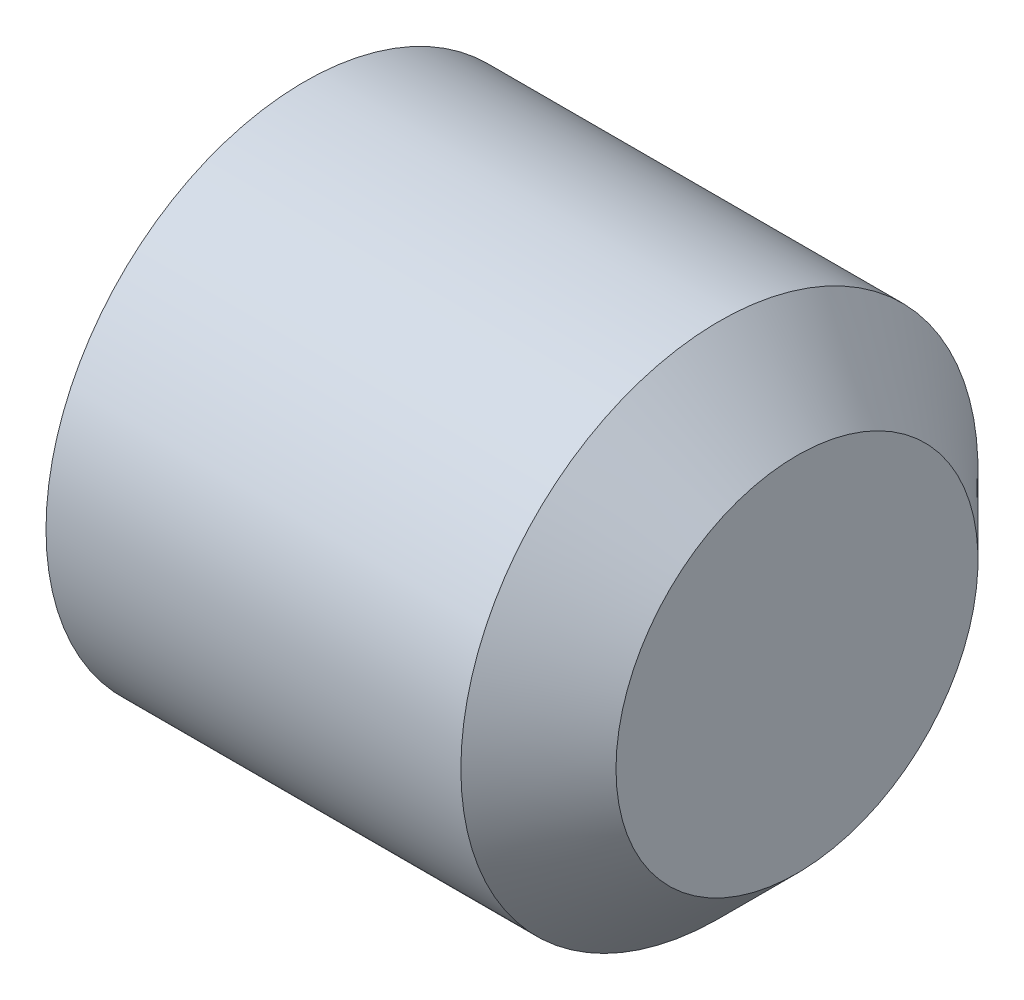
SolidWorks part; units mm, degrees
ref_plane "Plane1" through (0, 0, 0) normal (0, 0, 1) x (1, 0, 0)
ref_plane "Plane2" through (0, 0, 0) normal (0, 1, 0) x (1, 0, 0)
ref_plane "Plane3" through (0, 0, 0) normal (1, 0, 0) x (0, 0, -1)
sketch "BodySke" plane through (0, 0, 0) normal (0, 0, 1) x (1, 0, 0)
  line L0 (0, 0) -> (0, 4.172)
  line L1 (0, 4.172) -> (0.478, 5)
  line L2 (0.478, 5) -> (8.5, 5)
  line L3 (8.5, 5) -> (10, 3.5)
  line L4 (10, 0) -> (0, 0)
  line L5 (-12.7, 0) -> (88.9, 0) construction
  line L6 (10, 3.5) -> (10, 0)
  line L7 (10, 3.5) -> (10, 13.025) construction
  line L8 (0, -4.172) -> (0.478, -5) construction
  line L9 (1.5, 15.875) -> (1.5, -3.175) construction
  line L10 (8.5, -5) -> (10, -3.5) construction
  dimension "Length" = 10
  dimension "Diameter" = 10
  dimension "Drive_ch_ang" = 60
  dimension "Minor_dia" = 8.344
  dimension "Cup_nose_ang" = 45
  dimension "Cup_dia" = 7
  dimension "Advance" = 1.5
revolve "BaseBody" add sketch "BodySke" angle 360 about L5
sketch "Sketch2" plane through (0, 0, 0) normal (-1, 0, 0) x (0, 0, 1)
  line L0 (1.4434, 2.5) -> (-1.4434, 2.5)
  line L1 (-1.4434, 2.5) -> (-2.8868, 0)
  line L2 (1.4434, 2.5) -> (2.8868, 0)
  line L3 (1.4434, -2.5) -> (2.8868, 0)
  line L4 (1.4434, -2.5) -> (-1.4434, -2.5)
  line L5 (-1.4434, -2.5) -> (-2.8868, 0)
  dimension "Hex_size" = 5
  dimension "D2" = 2.5
  dimension "D3" = 2.5
extrude "Hex" cut sketch "Sketch2" against normal blind 5
sketch "Sketch4" plane through (0, 4.7709, -0.5249) normal (-1, 0, 0) x (0, 0, 1)
  line L0 (0.5249, -4.7709) -> (3.3314, -4.7709)
  line L1 (0.5249, -4.7709) -> (6.6732, -1.2211) construction
  line L2 (0.5249, -4.7709) -> (1.9281, -2.3404)
  line L3 (2.8584, -4.1568) -> (3.2099, -3.9539)
  line L4 (2.2234, -3.057) -> (2.5749, -2.8541)
  arc A0 (2.8584, -4.1568) -> (2.2234, -3.057) centre (0.5249, -4.7709) ccw
  arc A1 (3.3314, -4.7709) -> (3.2099, -3.9539) centre (0.5249, -4.7709) ccw
  arc A2 (1.9281, -2.3404) -> (2.5749, -2.8541) centre (0.5249, -4.7709) cw
  circle A3 centre (0.5249, -4.7709) radius 2.413 construction
  circle A4 centre (0.5249, -4.7709) radius 2.8065 construction
  dimension "D1" = 30
  dimension "Spline_n_dim" = 4.826
  dimension "Spline_m_dim" = 5.613
  dimension "Spline_a_dim" = 60
  dimension "D3" = 0.635
  dimension "Spline_p_dim" = 1.27
extrude "Spline6" [suppressed] cut sketch "Sketch4" against normal blind 5
pattern_circular "CirPattern1" [suppressed] count 6 every 60 about axis through (-12.7, 0, 0) along (1, 0, 0)
sketch "Sketch5" plane through (0, 0.6556, 6.6316) normal (-1, 0, 0) x (0, 0, 1)
  line L0 (-6.6316, -0.6556) -> (-3.8251, -0.6556)
  line L1 (-6.6316, -0.6556) -> (-1.6115, 4.3645) construction
  line L2 (-6.6316, -0.6556) -> (-6.6316, 2.1509)
  line L3 (-4.4764, 0.6017) -> (-4.2496, 0.8284)
  line L4 (-5.3744, 1.4997) -> (-5.1476, 1.7265)
  line L5 (-5.3744, 1.4997) -> (-4.4764, 0.6017)
  arc A1 (-3.8251, -0.6556) -> (-4.2496, 0.8284) centre (-6.6316, -0.6556) ccw
  arc A2 (-6.6316, 2.1509) -> (-5.1476, 1.7265) centre (-6.6316, -0.6556) cw
  circle A3 centre (-6.6316, -0.6556) radius 2.413 construction
  circle A4 centre (-6.6316, -0.6556) radius 2.8065 construction
  dimension "D1" = 45
  dimension "Spline_n_dim" = 4.826
  dimension "Spline_m_dim" = 5.613
  dimension "Spline_a_dim" = 90
  dimension "D3" = 0.635
  dimension "Spline_p_dim" = 1.27
extrude "Spline4" [suppressed] cut sketch "Sketch5" against normal blind 5
pattern_circular "CirPattern2" [suppressed] count 4 every 90 about axis through (-12.7, 0, 0) along (1, 0, 0)
sketch "ThdSchSke" plane through (0, 0, 0) normal (0, 0, 1) x (1, 0, 0)
  line L0 (0.478, -4.172) -> (-0.1017, -5)
  line L1 (0.478, -4.172) -> (1.0578, -5)
  line L2 (1.0578, -5) -> (1.0578, -6.25)
  line L3 (-3.175, 0) -> (5.1513, 0) construction
  line L4 (0.478, 5) -> (0.478, -5) construction
  line L5 (1.0578, -6.25) -> (-0.1017, -6.25)
  line L6 (-0.1017, -6.25) -> (-0.1017, -5)
  dimension "Thread_minor" = 8.344
  dimension "Diameter" = 10
  dimension "SideAngle" = 55
  dimension "VeeAngle" = 70
  dimension "Overcut" = 12.5
revolve "ThreadSchematic" [suppressed] cut sketch "ThdSchSke" angle 360 about L3
pattern_linear "ThdSchPat" [suppressed]
equation "\"D2@Sketch2\" = \"Hex_size@Sketch2\" / 2"
equation "\"D3@Sketch2\" = \"Hex_size@Sketch2\" / 2"
equation "\"Thread_minor@ThreadCosmetic\" = \"Minor_dia@BodySke\""
equation "\"D1@Sketch4\" = \"Spline_a_dim@Sketch4\" / 2"
equation "\"D3@Sketch4\" = \"Spline_p_dim@Sketch4\" / 2"
equation "\"D2@CirPattern1\" = \"Spline_a_dim@Sketch4\""
equation "\"Num_teeth@CirPattern1\" = 360 / \"D2@CirPattern1\""
equation "\"Spline_a_dim@Sketch5\" = 90"
equation "\"Spline_p_dim@Sketch5\" = \"Spline_p_dim@Sketch4\""
equation "\"Spline_m_dim@Sketch5\" = \"Spline_m_dim@Sketch4\""
equation "\"Spline_n_dim@Sketch5\" = \"Spline_n_dim@Sketch4\""
equation "\"D1@Sketch5\" = \"Spline_a_dim@Sketch5\" / 2"
equation "\"D3@Sketch5\" = \"Spline_p_dim@Sketch5\" / 2"
equation "\"Key_eng@Spline4\" = \"Key_eng@Spline6\""
equation "\"Thread_minor@ThdSchSke\" = \"Thread_minor@ThreadCosmetic\""
equation "\"Diameter@ThdSchSke\" = \"Diameter@BodySke\""
equation "\"Overcut@ThdSchSke\" = \"Diameter@BodySke\" * 1.25"
equation "\"Num_threads@ThdSchPat\" = int( (\"Length@BodySke\" - ( ( ( \"Diameter@BodySke\" - \"Minor_dia@BodySke\" ) * 0.5 ) / tan( \"Drive_ch_ang@BodySke\" * 0.017453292 ) ) - ( ( ( \"Diameter@BodySke\" - \"Cup_dia@BodySk"
equation "\"Advance@ThdSchPat\" = (\"Length@BodySke\" - ( ( ( \"Diameter@BodySke\" - \"Minor_dia@BodySke\" ) * 0.5 ) / tan( \"Drive_ch_ang@BodySke\" * 0.017453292 ) ) - ( ( ( \"Diameter@BodySke\" - \"Cup_dia@BodySke\" ) * 0."
equation "' \"Num_threads@ThdSchPat\" = \"Num_threads@ThdSchPat\" - sgn( \"Num_threads@ThdSchPat\" - 1) '---chamfered tips only---"
